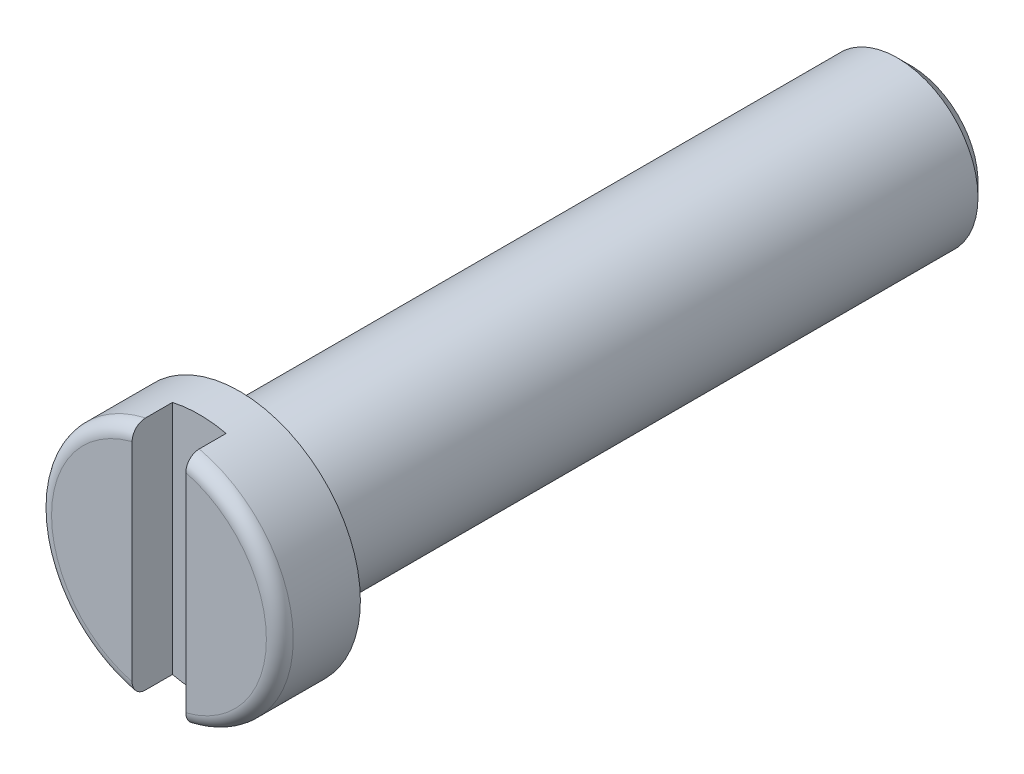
SolidWorks part; units mm, degrees
ref_plane "Plan de face" through (0, 0, 0) normal (0, 0, 1) x (1, 0, 0)
ref_plane "Plan de dessus" through (0, 0, 0) normal (0, 1, 0) x (1, 0, 0)
ref_plane "Plan de droite" through (0, 0, 0) normal (1, 0, 0) x (0, 0, -1)
sketch "Esquisse1" plane through (0, 0, 0) normal (0, 0, 1) x (1, 0, 0)
  circle A0 centre (0, 0) radius 4.5
  dimension "D1" = 9
extrude "Boss.-Extru.1" add sketch "Esquisse1" along normal blind 3
sketch "Esquisse2" plane through (0, 0, 0) normal (0, 0, -1) x (-1, 0, 0)
  circle A0 centre (0, 0) radius 3
  circle A1 centre (0, 0) radius 2
  dimension "D1" = 6
  dimension "D2" = 1
extrude "Boss.-Extru.2" add sketch "Esquisse2" along normal blind 25
chamfer "Chanfrein1" distance 0.5 angle 45 1 edges at (-3, 0, -25)
fillet "Congé1" radius 0.5 1 edges at (4.5, 0, 3)
sketch "Esquisse3" plane through (0, 0, 3) normal (0, 0, 1) x (1, 0, 0)
  line L1 (-1, 4.8447) -> (1, 4.8447)
  line L2 (-1, 4.8447) -> (-1, -5.0946)
  line L3 (-1, -5.0946) -> (1, -5.0946)
  line L4 (1, 4.8447) -> (1, -5.0946)
  dimension "D1" = 1
  dimension "D2" = 2
extrude "Enlèv. mat.-Extru.1" cut sketch "Esquisse3" against normal blind 1.5
